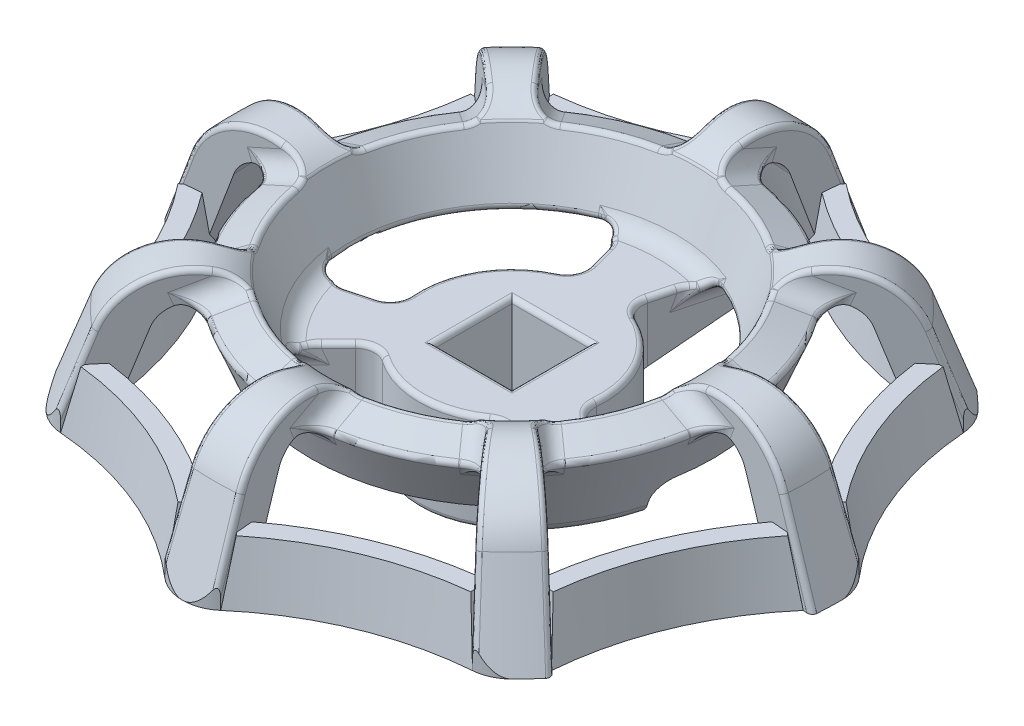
SolidWorks part; units mm, degrees
ref_plane "Front Plane" through (0, 0, 0) normal (0, 0, 1) x (1, 0, 0)
ref_plane "Top Plane" through (0, 0, 0) normal (0, 1, 0) x (1, 0, 0)
ref_plane "Right Plane" through (0, 0, 0) normal (1, 0, 0) x (0, 0, -1)
imported_body "STOP & WASTE-1-1-solid1"
imported_body "STOP & WASTE-3-1-solid1"
imported_body "STOP & WASTE-2-1-solid1"
imported_body "STOP & WASTE-4-1-solid1"
imported_body "STOP & WASTE-7-1-solid1"
imported_body "STOP & WASTE-9-1-solid1"
sketch "Sketch1" plane through (0, 43.4245, 0) normal (0, 1, 0) x (1, 0, 0)
  circle A0 centre (0, 0) radius 35.0256
extrude "Cut-Extrude1" cut sketch "Sketch1" against normal blind 71
